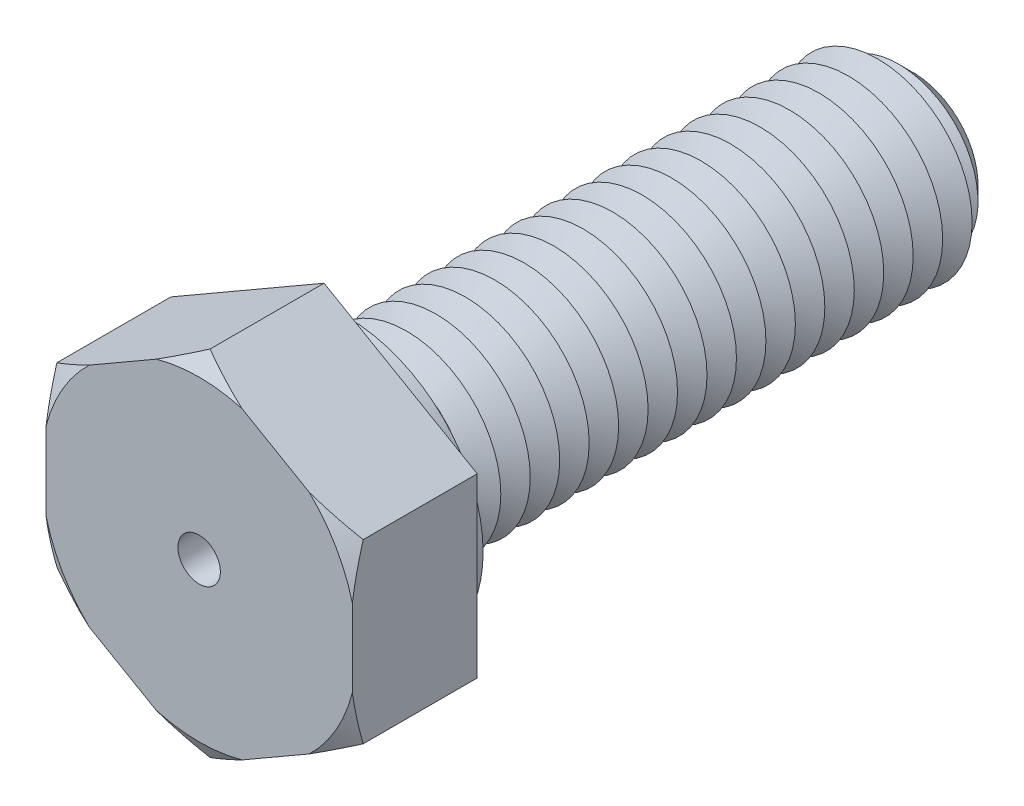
SolidWorks part; units mm, degrees
ref_plane "Front Plane" through (0, 0, 0) normal (0, 0, 1) x (1, 0, 0)
ref_plane "Top Plane" through (0, 0, 0) normal (0, 1, 0) x (1, 0, 0)
ref_plane "Right Plane" through (0, 0, 0) normal (1, 0, 0) x (0, 0, -1)
sketch "Sketch2" plane through (0, 0, 0) normal (0, 0, 1) x (1, 0, 0)
  line L1 (0, 7.5056) -> (-6.5, 3.7528)
  line L2 (-6.5, 3.7528) -> (-6.5, -3.7528)
  line L3 (-6.5, -3.7528) -> (0, -7.5056)
  line L4 (0, -7.5056) -> (6.5, -3.7528)
  line L5 (6.5, -3.7528) -> (6.5, 3.7528)
  line L6 (6.5, 3.7528) -> (0, 7.5056)
  circle A0 centre (0, 0) radius 6.5 construction
  dimension "D1" = 13
extrude "Boss-Extrude1" add sketch "Sketch2" along normal blind 5.3
sketch "Sketch3" plane through (0, 0, 0) normal (0, 0, -1) x (-1, 0, 0)
  circle A0 centre (0, 0) radius 4
  dimension "D1" = 8
extrude "Boss-Extrude2" add sketch "Sketch3" along normal blind 25
sketch "Sketch4" plane through (0, 0, 0) normal (0, 0, -1) x (-1, 0, 0)
  circle A0 centre (0, 0) radius 5.75
  dimension "D1" = 11.5
extrude "Boss-Extrude3" add sketch "Sketch4" along normal blind 1
sketch "Sketch5" plane through (0, 0, 0) normal (1, 0, 0) x (0, 0, -1)
  line L0 (-3.2117, 0) -> (6.3192, 0) construction
chamfer "Chamfer1" distance 1.25 angle 45 1 edges at (-4, 0, -25)
sketch "Sketch6" plane through (0, 0, 0) normal (1, 0, 0) x (0, 0, -1)
  line L0 (1, 4) -> (1.625, 2.9175)
  line L1 (1.625, 2.9175) -> (2.25, 4)
  line L2 (23.75, 4) -> (1, 4) construction
  line L3 (2.25, 4) -> (1, 4)
  dimension "D1" = 1.25
revolve "Cut-Revolve1" cut sketch "Sketch6" angle 360 about L0
pattern_linear "LPattern1" count 19 spacing 1.25 along (0, 0, -1) of "Cut-Revolve1"
sketch "Sketch7" plane through (0, 0, 0) normal (1, 0, 0) x (0, 0, -1)
  line L0 (-5.3, 7.5056) -> (-5.3, 6.7056)
  line L1 (-5.3, 3.7528) -> (-5.3, 7.5056) construction
  line L2 (-5.3, 6.7056) -> (-4.8381, 7.5056)
  line L3 (-5.3, 7.5056) -> (0, 7.5056) construction
  line L4 (-4.8381, 7.5056) -> (-5.3, 7.5056)
  dimension "D1" = 0.8
  dimension "D2" = 30
revolve "Cut-Revolve2" cut sketch "Sketch7" angle 360 about L0
sketch "Sketch8" plane through (0, 0, 5.3) normal (0, 0, 1) x (1, 0, 0)
  circle A0 centre (0, 0) radius 0.9
  dimension "D1" = 1.8
extrude "Cut-Extrude1" cut sketch "Sketch8" against normal up to surface (30.3 mm away)
